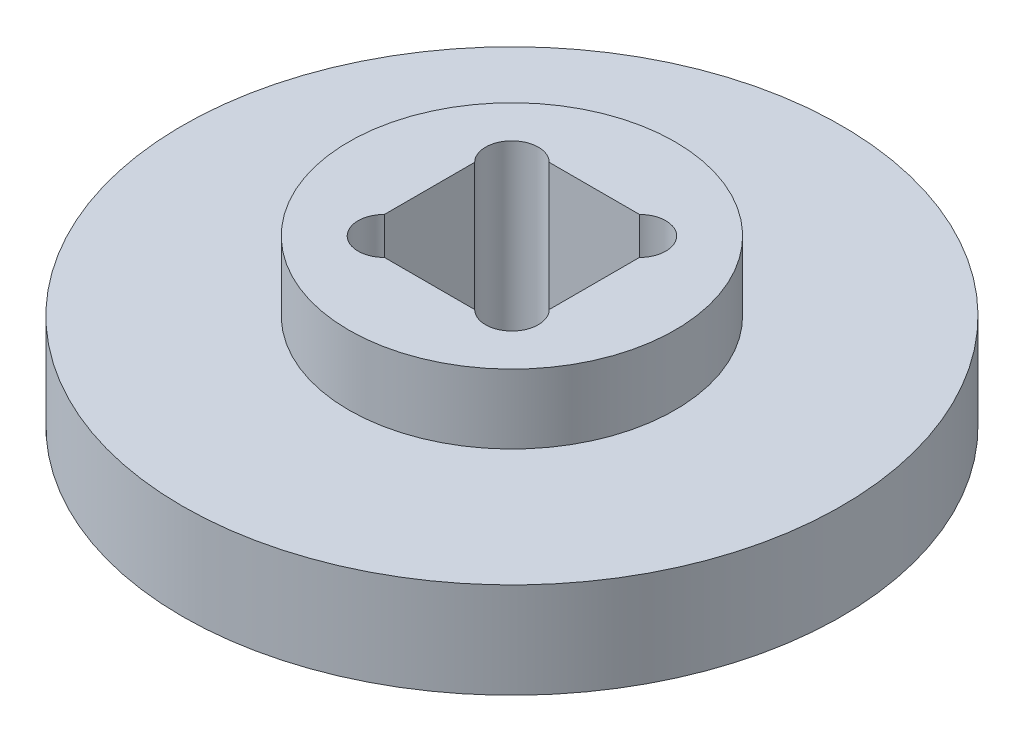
SolidWorks part; units mm, degrees
ref_plane "Plan de face" through (0, 0, 0) normal (0, 0, 1) x (1, 0, 0)
ref_plane "Plan de dessus" through (0, 0, 0) normal (0, 1, 0) x (1, 0, 0)
ref_plane "Plan de droite" through (0, 0, 0) normal (1, 0, 0) x (0, 0, -1)
sketch "Esquisse1" plane through (0, 0, 0) normal (0, 1, 0) x (1, 0, 0)
  circle A0 centre (0, 0) radius 20
extrude "Boss.-Extru.1" add sketch "Esquisse1" along normal blind 5.8
sketch "Esquisse2" plane through (0, 5.8, 0) normal (0, 1, 0) x (1, 0, 0)
  circle A0 centre (0, 0) radius 9.9
extrude "Boss.-Extru.2" add sketch "Esquisse2" along normal blind 4.2
sketch "Esquisse3" plane through (0, 10, 0) normal (0, 1, 0) x (1, 0, 0)
  line L0 (0, 5) -> (0, -7.0986) construction
  line L1 (-2.7373, 5) -> (2.7373, 5)
  line L2 (-5, 2.7373) -> (-5, -2.7373)
  line L3 (-2.7373, -5) -> (2.7373, -5)
  line L4 (5, 2.7373) -> (5, -2.7373)
  line L5 (-5, 5) -> (5, -5) construction
  line L6 (-5, -5) -> (5, 5) construction
  line L7 (-5, 0) -> (6.3098, 0) construction
  arc A0 (-2.7373, 5) -> (-5, 2.7373) centre (-3.8686, 3.8686) ccw
  arc A1 (2.7373, 5) -> (5, 2.7373) centre (3.8686, 3.8686) cw
  arc A2 (2.7373, -5) -> (5, -2.7373) centre (3.8686, -3.8686) ccw
  arc A3 (-2.7373, -5) -> (-5, -2.7373) centre (-3.8686, -3.8686) cw
  point P0 (0, 0)
  point P10 (-3.8686, 3.8686)
  dimension "D3" = 1.6
  dimension "D1" = 10
  dimension "D2" = 10
extrude "Enlèv. mat.-Extru.1" cut sketch "Esquisse3" against normal through all
